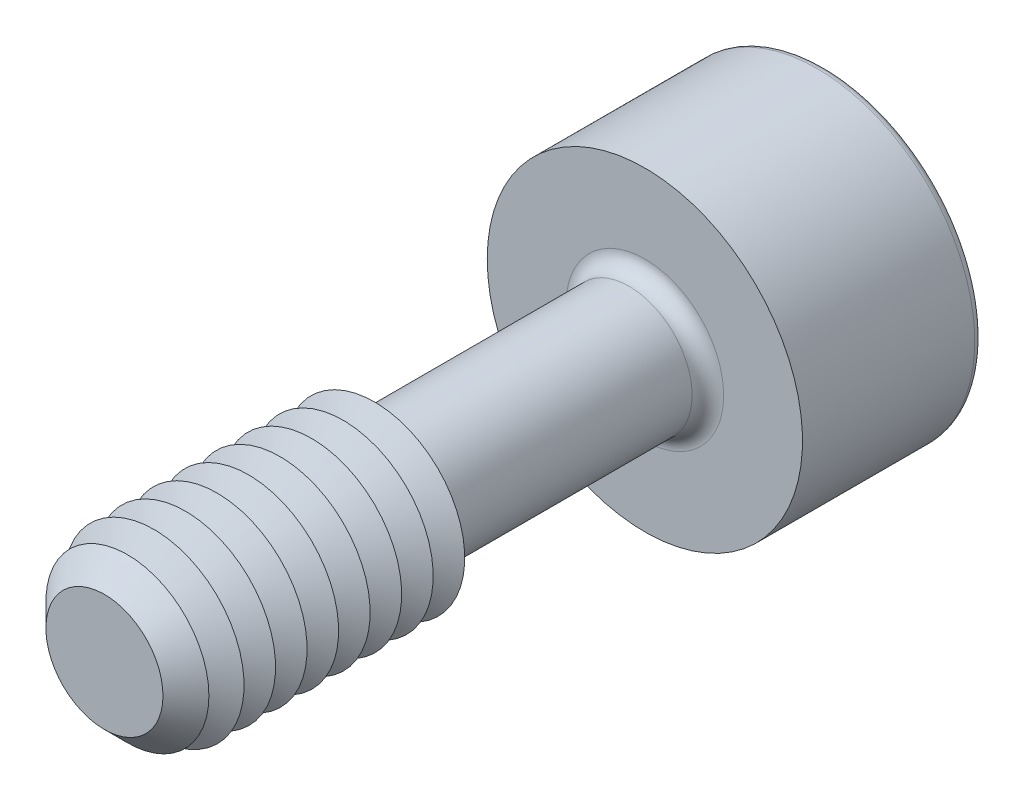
SolidWorks part; units mm, degrees
ref_plane "Front Plane" through (0, 0, 0) normal (0, 0, 1) x (1, 0, 0)
ref_plane "Top Plane" through (0, 0, 0) normal (0, 1, 0) x (1, 0, 0)
ref_plane "Right Plane" through (0, 0, 0) normal (1, 0, 0) x (0, 0, -1)
sketch "Sketch1" plane through (0, 0, 0) normal (0, 0, 1) x (1, 0, 0)
  circle A0 centre (0, 0) radius 1.4
  dimension "D1" = 2.8
extrude "Extrude1" add sketch "Sketch1" along normal mid plane 12
sketch "Sketch2" plane through (0, 0, 0) normal (1, 0, 0) x (0, 0, -1)
  line L0 (-6, 0) -> (-6, 2)
  line L1 (-6, 1.4) -> (-6, -1.4) construction
  line L2 (-6, 2) -> (0, 2)
  line L3 (0, 2) -> (0.3464, 1.4)
  line L4 (6, 1.4) -> (-6, 1.4) construction
  line L5 (0.3464, 1.4) -> (0.3464, 0)
  line L6 (0.3464, 0) -> (-6, 0)
  dimension "D1" = 2
  dimension "D2" = 120
  dimension "D3" = 6
revolve "Revolve1" add sketch "Sketch2" angle 360 about L6
chamfer "Chamfer1" distance 0.7 angle 45 1 edges at (0, 2, 6)
sketch "Sketch3" plane through (0, 0, -6) normal (0, 0, -1) x (-1, 0, 0)
  circle A0 centre (0, 0) radius 3.5
  dimension "D1" = 7
extrude "Extrude2" add sketch "Sketch3" along normal blind 4
sketch "Sketch4" plane through (-13.7, 0, -10) normal (0, 0, 1) x (1, 0, 0)
  line L2 (12.834, -1.5) -> (14.566, -1.5)
  line L3 (14.566, -1.5) -> (15.4321, 0)
  line L4 (15.4321, 0) -> (14.566, 1.5)
  line L6 (14.566, 1.5) -> (12.834, 1.5)
  line L7 (12.834, 1.5) -> (11.9679, 0)
  line L8 (11.9679, 0) -> (12.834, -1.5)
  circle A0 centre (13.7, 0) radius 1.5 construction
  dimension "D1" = 3
extrude "Extrude3" cut sketch "Sketch4" along normal blind 3
fillet "Fillet1" radius 0.35 1 edges at (-1.4, 0, -6)
fillet "Fillet2" radius 0.175 1 edges at (-3.5, 0, -10)
sketch "Sketch5" plane through (0, 0, 0) normal (1, 0, 0) x (0, 0, -1)
  line L0 (7, 0) -> (7, -1.5)
  line L1 (7, -1.5) -> (6.134, 0)
  line L2 (6.134, 0) -> (7, 0)
  dimension "D1" = 30
revolve "Cut-Revolve1" cut sketch "Sketch5" angle 360 about L2
sketch "Sketch6" plane through (0, 0, 0) normal (1, 0, 0) x (0, 0, -1)
  line L0 (1.332, 0) -> (-13.289, 0) construction
sketch "Sketch7" plane through (0, 0, 0) normal (1, 0, 0) x (0, 0, -1)
  line L0 (0, 2) -> (-0.35, 1.3938)
  line L1 (-0.35, 1.3938) -> (-0.7, 2)
  line L2 (0, 2) -> (-5.3, 2) construction
  line L3 (-0.7, 2) -> (0, 2)
  dimension "D1" = 0.7
revolve "Cut-Revolve2" cut sketch "Sketch7" angle 360 about L0
pattern_linear "LPattern1" count 8 spacing 0.7 along (0, 0, 1) of "Cut-Revolve2"
